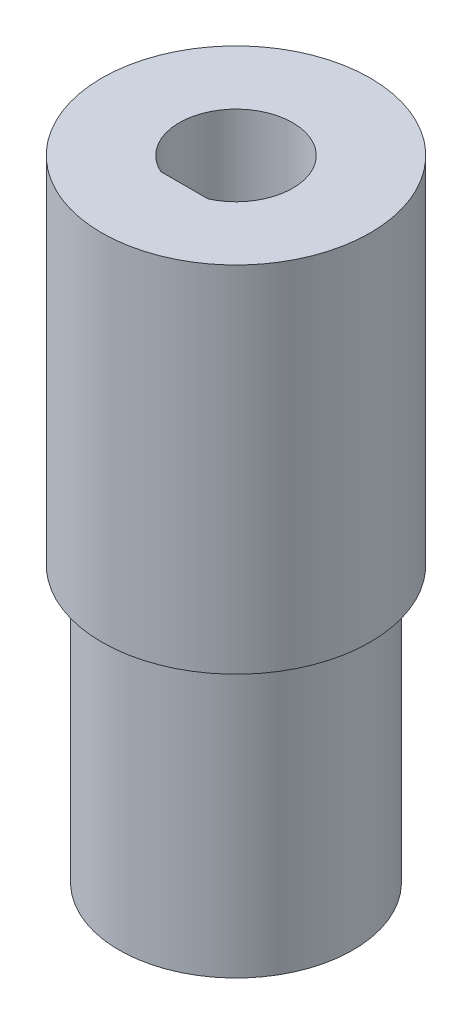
SolidWorks part; units mm, degrees
ref_plane "Ebene vorne" through (0, 0, 0) normal (0, 0, 1) x (1, 0, 0)
ref_plane "Ebene oben" through (0, 0, 0) normal (0, 1, 0) x (1, 0, 0)
ref_plane "Ebene rechts" through (0, 0, 0) normal (1, 0, 0) x (0, 0, -1)
sketch "Skizze1" plane through (0, 0, 0) normal (0, 0, 1) x (1, 0, 0)
  line L0 (0, 0) -> (0, 14.6571) construction
  line L1 (0, 0) -> (-3.4, 0)
  line L2 (-3.4, 0) -> (-3.4, 8)
  line L3 (-3.4, 8) -> (-3.9, 8)
  line L4 (-3.9, 8) -> (-3.9, 18.3)
  line L5 (-3.9, 18.3) -> (0, 18.3)
  line L6 (0, 18.3) -> (0, 0)
  dimension "D1" = 3.4
  dimension "D2" = 3.9
  dimension "D3" = 8
  dimension "D4" = 10.3
revolve "Rotation1" add sketch "Skizze1" angle 360 about L0
sketch "Skizze3" plane through (0, 0, 0) normal (0, -1, 0) x (1, 0, 0)
  line L0 (0, 0) -> (0, 2.45) construction
  line L1 (0, 0) -> (2.45, 0) construction
  line L2 (0.85, 2.2978) -> (0.85, 1.25)
  line L3 (1.25, 0.85) -> (2.2978, 0.85)
  line L4 (2.2978, -0.85) -> (1.25, -0.85)
  line L5 (0.85, -1.25) -> (0.85, -2.2978)
  line L6 (-0.85, -2.2978) -> (-0.85, -1.25)
  line L7 (-1.25, -0.85) -> (-2.2978, -0.85)
  line L8 (-2.2978, 0.85) -> (-1.25, 0.85)
  line L9 (-0.85, 1.25) -> (-0.85, 2.2978)
  arc A0 (2.45, 0) -> (2.2978, 0.85) centre (0, 0) ccw
  arc A1 (0.85, 1.25) -> (1.25, 0.85) centre (1.25, 1.25) ccw
  arc A2 (0.85, 2.2978) -> (0, 2.45) centre (0, 0) ccw
  arc A3 (2.2978, -0.85) -> (2.45, 0) centre (0, 0) ccw
  arc A4 (1.25, -0.85) -> (0.85, -1.25) centre (1.25, -1.25) ccw
  arc A5 (0, -2.45) -> (0.85, -2.2978) centre (0, 0) ccw
  arc A6 (-0.85, -2.2978) -> (0, -2.45) centre (0, 0) ccw
  arc A7 (-0.85, -1.25) -> (-1.25, -0.85) centre (-1.25, -1.25) ccw
  arc A8 (-2.45, 0) -> (-2.2978, -0.85) centre (0, 0) ccw
  arc A9 (-2.2978, 0.85) -> (-2.45, 0) centre (0, 0) ccw
  arc A10 (-1.25, 0.85) -> (-0.85, 1.25) centre (-1.25, 1.25) ccw
  arc A11 (0, 2.45) -> (-0.85, 2.2978) centre (0, 0) ccw
  point P33 (0, 0)
  dimension "D4" = 0.4
  dimension "D1" = 2.45
  dimension "D2" = 0.85
  dimension "D3" = 0.85
  dimension "D5" = 4
extrude "Schnitt-Linear austragen1" cut sketch "Skizze3" against normal blind 8
sketch "Skizze4" plane through (0, 18.3, 0) normal (0, 1, 0) x (1, 0, 0)
  line L0 (-0.6874, -1.5) -> (0.6874, -1.5)
  arc A0 (0.6874, -1.5) -> (-0.6874, -1.5) centre (0, 0) ccw
  point P5 (0, -1.5)
  dimension "D1" = 3.3
  dimension "D2" = 1.5
extrude "Schnitt-Linear austragen2" cut sketch "Skizze4" against normal blind 10
